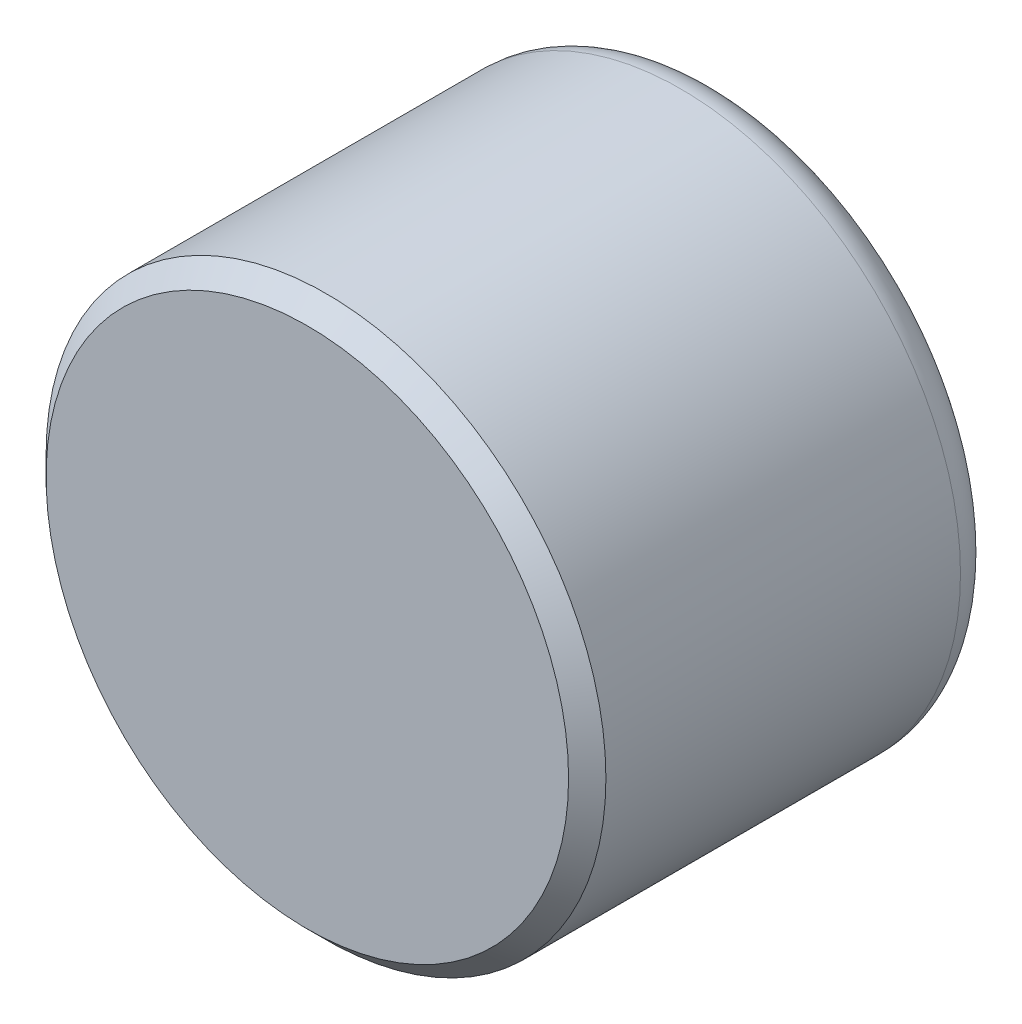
SolidWorks part; units mm, degrees
ref_plane "Face" through (0, 0, 0) normal (0, 0, 1) x (1, 0, 0)
ref_plane "Dessus" through (0, 0, 0) normal (0, 1, 0) x (1, 0, 0)
ref_plane "Droite" through (0, 0, 0) normal (1, 0, 0) x (0, 0, -1)
sketch "Esquisse1" plane through (0, 0, 0) normal (0, 0, 1) x (1, 0, 0)
  circle A0 centre (0, 0) radius 15
  dimension "D1" = 30
extrude "Extrusion1" add sketch "Esquisse1" along normal blind 22
sketch "Esquisse2" plane through (0, 0, 0) normal (0, 0, -1) x (-1, 0, 0)
  circle A0 centre (0, 0) radius 10
  dimension "D1" = 20
extrude "Enlèv. mat.-Extru.1" cut sketch "Esquisse2" against normal blind 15
sketch "Esquisse3" plane through (0, 0, 15) normal (0, 0, -1) x (-1, 0, 0)
  circle A0 centre (0, 0) radius 3.5
  dimension "D1" = 7
extrude "Enlèv. mat.-Extru.2" cut sketch "Esquisse3" against normal blind 13 draft 60
chamfer "Chanfrein1" distance 1 angle 45 1 edges at (15, 0, 22)
fillet "Congé2" radius 2 2 edges at (15, 0, 0) (-10, 0, 0)
